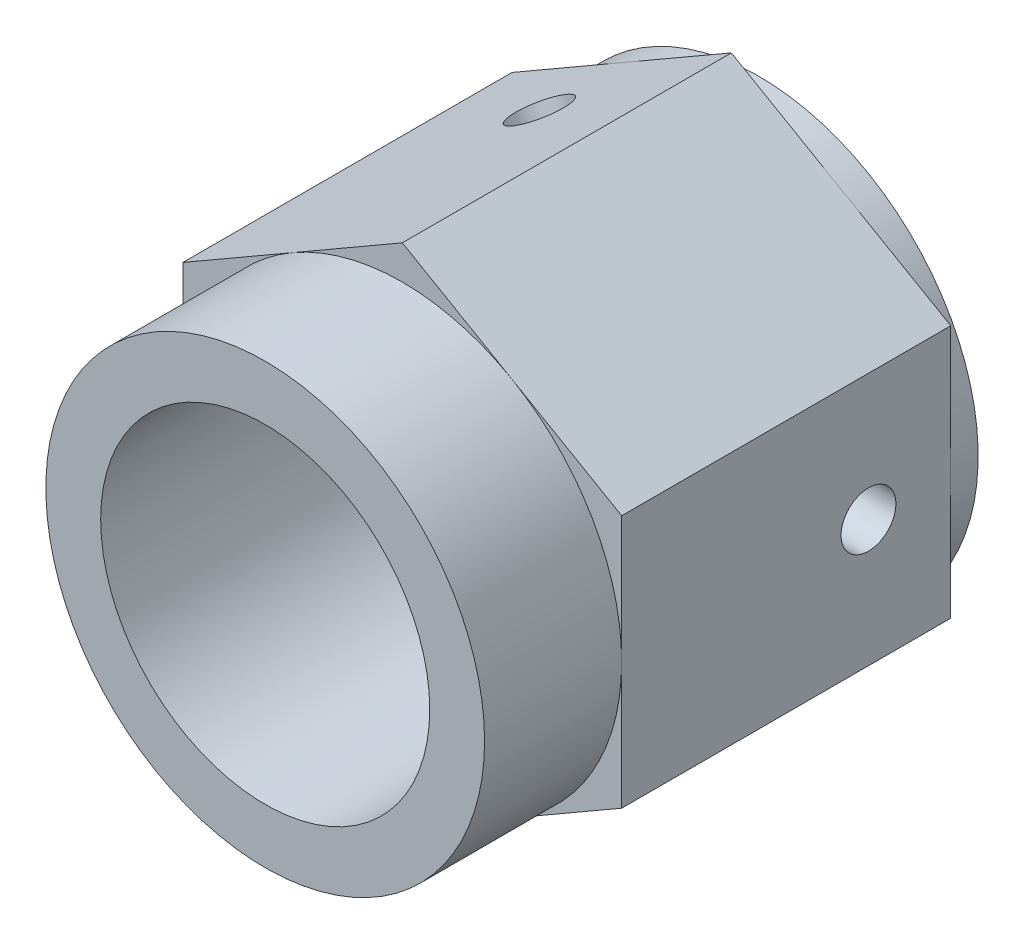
SolidWorks part; units mm, degrees
ref_plane "前视基准面" through (0, 0, 0) normal (0, 0, 1) x (1, 0, 0)
ref_plane "上视基准面" through (0, 0, 0) normal (0, 1, 0) x (1, 0, 0)
ref_plane "右视基准面" through (0, 0, 0) normal (1, 0, 0) x (0, 0, -1)
sketch "草图1" plane through (0, 0, 0) normal (0, 0, 1) x (1, 0, 0)
  line L1 (0, 46.188) -> (-40, 23.094)
  line L2 (-40, 23.094) -> (-40, -23.094)
  line L3 (-40, -23.094) -> (0, -46.188)
  line L4 (0, -46.188) -> (40, -23.094)
  line L5 (40, -23.094) -> (40, 23.094)
  line L6 (40, 23.094) -> (0, 46.188)
  circle A0 centre (0, 0) radius 40 construction
extrude "凸台-拉伸1" add sketch "草图1" along normal blind 60
sketch "草图2" plane through (0, 0, 60) normal (0, 0, 1) x (1, 0, 0)
  circle A0 centre (0, 0) radius 40
extrude "凸台-拉伸2" add sketch "草图2" along normal blind 25
sketch "草图3" plane through (0, 0, 0) normal (0, 0, -1) x (-1, 0, 0)
  circle A0 centre (0, 0) radius 40
extrude "凸台-拉伸3" add sketch "草图3" along normal blind 5
sketch "草图4" plane through (0, 0, -5) normal (0, 0, -1) x (-1, 0, 0)
  circle A0 centre (0, 0) radius 15
extrude "切除-拉伸1" cut sketch "草图4" against normal blind 45
sketch "草图5" plane through (0, 0, 85) normal (0, 0, 1) x (1, 0, 0)
  circle A0 centre (0, 0) radius 30
  dimension "D1" = 60
extrude "切除-拉伸2" cut sketch "草图5" against normal blind 45
sketch "草图6" plane through (-20, 34.641, 0) normal (-0.5, 0.866, 0) x (0.866, 0.5, 0)
  line L0 (0, 0) -> (0, -15) construction
  circle A0 centre (0, -15) radius 5
extrude "切除-拉伸3" cut sketch "草图6" against normal blind 30
sketch "草图7" plane through (-20, -34.641, 0) normal (-0.5, -0.866, 0) x (0.866, -0.5, 0)
  line L0 (0, 0) -> (0, 15) construction
  circle A0 centre (0, 15) radius 5
extrude "切除-拉伸4" cut sketch "草图7" against normal blind 30
sketch "草图8" plane through (40, 0, 0) normal (1, 0, 0) x (0, 0, -1)
  line L0 (0, 0) -> (-15, 0) construction
  circle A0 centre (-15, 0) radius 5
extrude "切除-拉伸5" cut sketch "草图8" against normal blind 30
